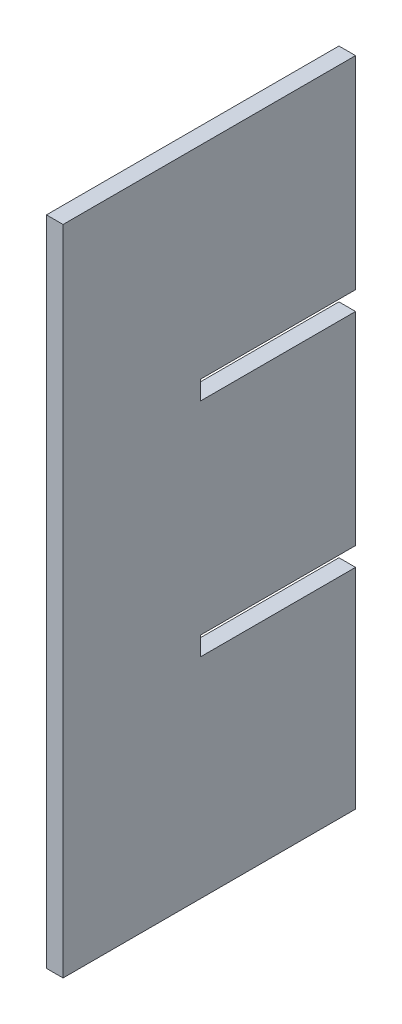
SolidWorks part; units mm, degrees
ref_plane "Alzado" through (0, 0, 0) normal (0, 0, 1) x (1, 0, 0)
ref_plane "Planta" through (0, 0, 0) normal (0, 1, 0) x (1, 0, 0)
ref_plane "Vista lateral" through (0, 0, 0) normal (1, 0, 0) x (0, 0, -1)
sketch "Croquis16" plane through (0, 0, 0) normal (0, 0, 1) x (1, 0, 0)
  line L0 (-18.25, -39.75) -> (-16.75, -39.75)
  line L1 (-18.5, -40) -> (-16.5, -40) construction
  line L2 (-18.5, -40) -> (-18.5, 40) construction
  line L3 (-18.5, 40) -> (-16.5, 40) construction
  line L4 (-16.5, -40) -> (-16.5, 40) construction
  line L5 (-16.75, -39.75) -> (-16.75, 39.75)
  line L6 (-18.25, 39.75) -> (-16.75, 39.75)
  line L7 (-18.25, -39.75) -> (-18.25, 39.75)
  dimension "D1" = 0.25
extrude "Saliente-Extruir9" add sketch "Croquis16" along normal blind 26.4
sketch "Croquis20" plane through (-16.75, 0, 0) normal (1, 0, 0) x (0, 0, -1)
  line L1 (0, -20.85) -> (-14, -20.85)
  line L2 (0, -20.85) -> (0, -19.15)
  line L3 (0, -19.15) -> (-14, -19.15)
  line L4 (-14, -20.85) -> (-14, -19.15)
  line L10 (0, -0.85) -> (-14, -0.85)
  line L11 (0, -0.85) -> (0, 0.85)
  line L12 (0, 0.85) -> (-14, 0.85)
  line L13 (-14, -0.85) -> (-14, 0.85)
  line L14 (0, 19.15) -> (-14, 19.15)
  line L15 (0, 19.15) -> (0, 20.85)
  line L16 (0, 20.85) -> (-14, 20.85)
  line L17 (-14, 19.15) -> (-14, 20.85)
  line L22 (0, -39.75) -> (0, 39.75) construction
  dimension "D1" = 1.7
  dimension "D2" = 14
  dimension "D4" = 1.7
  dimension "D5" = 1.7
  dimension "D6" = 14
  dimension "D7" = 14
extrude "Cortar-Extruir2" cut sketch "Croquis20" against normal up to surface (1.5 mm away)
sketch "Croquis21" plane through (-16.75, 0, 0) normal (1, 0, 0) x (0, 0, -1)
  line L1 (0, 19.15) -> (-26.4, 19.15)
  line L2 (0, 19.15) -> (0, 39.75)
  line L3 (0, 39.75) -> (-26.4, 39.75)
  line L4 (-26.4, 19.15) -> (-26.4, 39.75)
  line L5 (-14, 19.15) -> (0, 19.15) construction
extrude "Cortar-Extruir3" cut sketch "Croquis21" against normal up to surface (1.5 mm away)
